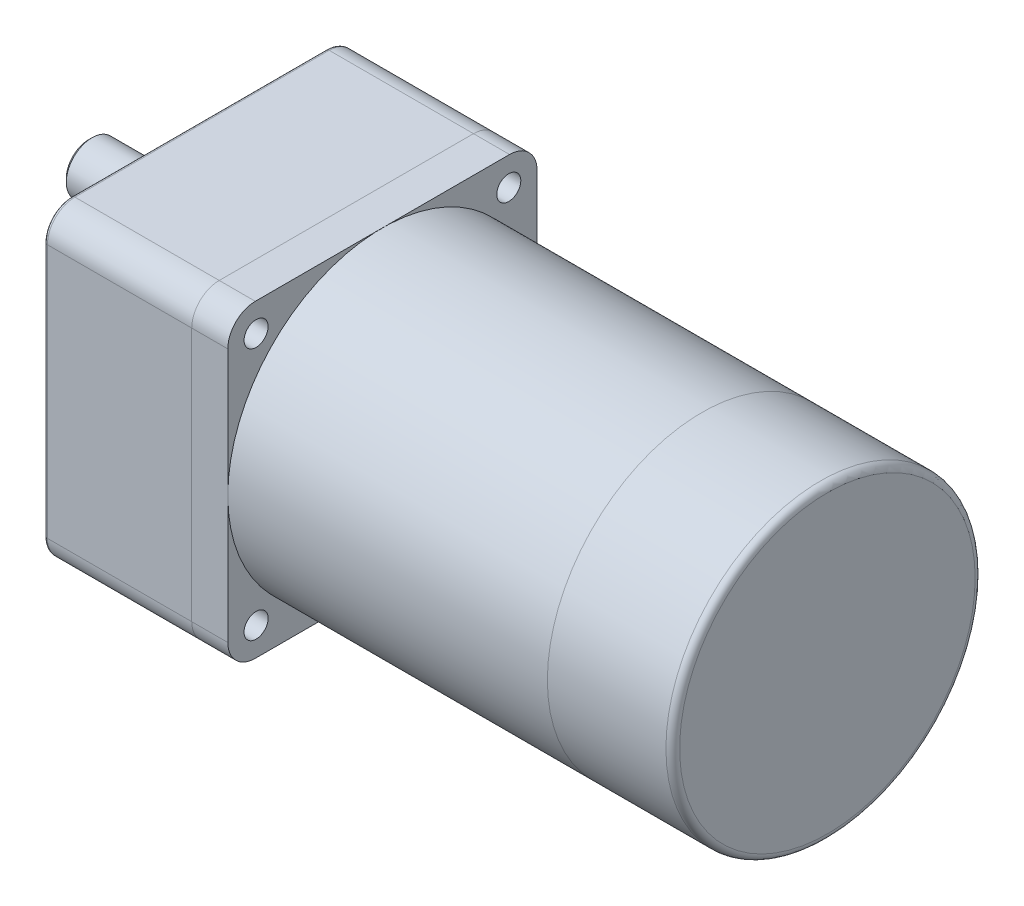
SolidWorks part; units mm, degrees
ref_plane "前视基准面" through (0, 0, 0) normal (0, 0, 1) x (1, 0, 0)
ref_plane "上视基准面" through (0, 0, 0) normal (0, 1, 0) x (1, 0, 0)
ref_plane "右视基准面" through (0, 0, 0) normal (1, 0, 0) x (0, 0, -1)
sketch "草图1" plane through (0, 0, 0) normal (1, 0, 0) x (0, 0, -1)
  line L1 (-37, -45) -> (37, -45)
  line L2 (-45, -37) -> (-45, 37)
  line L3 (-37, 45) -> (37, 45)
  line L4 (45, -37) -> (45, 37)
  line L5 (-45, -45) -> (45, 45) construction
  line L6 (-45, 45) -> (45, -45) construction
  arc A0 (-37, -45) -> (-45, -37) centre (-37, -37) cw
  arc A1 (37, -45) -> (45, -37) centre (37, -37) ccw
  arc A2 (37, 45) -> (45, 37) centre (37, 37) cw
  arc A3 (-45, 37) -> (-37, 45) centre (-37, 37) cw
  point P0 (0, 0)
  dimension "D1" = 8
extrude "凸台-拉伸1" add sketch "草图1" along normal blind 43
sketch "草图2" plane through (43, 0, 0) normal (1, 0, 0) x (0, 0, -1)
  line L0 (37, 45) -> (-37, 45) construction
  line L1 (-37, -45) -> (37, -45)
  line L2 (-45, -37) -> (-45, 37)
  line L3 (-37, 45) -> (37, 45)
  line L4 (45, -37) -> (45, 37)
  line L5 (-45, -45) -> (45, 45) construction
  line L6 (-45, 45) -> (45, -45) construction
  arc A0 (37, 45) -> (45, 37) centre (37, 37) cw
  arc A1 (37, -45) -> (45, -37) centre (37, -37) ccw
  arc A2 (-37, -45) -> (-45, -37) centre (-37, -37) cw
  arc A3 (-45, 37) -> (-37, 45) centre (-37, 37) cw
  point P0 (0, 0)
  dimension "D1" = 8
extrude "凸台-拉伸2" add sketch "草图2" along normal blind 10.5 separate body
fillet "圆角1" radius 1 8 edges at (0, -45, 0) (0, -42.6569, -42.6569) (0, 0, -45) (0, 42.6569, -42.6569) (0, 45, 0) (0, 42.6569, 42.6569) (0, 0, 45) (0, -42.6569, 42.6569)
sketch "草图6" plane through (0, 0, 0) normal (-1, 0, 0) x (0, 0, 1)
  circle A0 centre (0, 18) radius 16
extrude "凸台-拉伸5" add sketch "草图6" along normal blind 3 separate body
fillet "圆角3" radius 0.5 1 edges at (-3, 18, 16)
sketch "草图7" plane through (-3, 0, 0) normal (-1, 0, 0) x (0, 0, 1)
  circle A0 centre (0, 18) radius 7.5
extrude "凸台-拉伸6" add sketch "草图7" along normal blind 29 separate body
ref_plane "基准面1" through (0, 0, -7.5) normal (0, 0, 1) x (1, 0, 0)
sketch "草图8" plane through (0, 0, -7.5) normal (0, 0, 1) x (1, 0, 0)
  line L1 (-32, 25.5) -> (-32, 10.5) construction
  line L2 (-9.5, 20.5) -> (-32, 20.5)
  line L3 (-32, 20.5) -> (-32, 15.5)
  line L4 (-32, 15.5) -> (-9.5, 15.5)
  arc A0 (-9.5, 15.5) -> (-9.5, 20.5) centre (-9.5, 18) ccw
extrude "切除-拉伸2" cut sketch "草图8" along normal blind 3
chamfer "倒角2" distance 1 angle 45 1 edges at (-32, 18, 7.5)
sketch "草图9" plane through (0, 0, 0) normal (-1, 0, 0) x (0, 0, 1)
  circle A0 centre (0, 0) radius 41.4
extrude "切除-拉伸3" cut sketch "草图9" against normal blind 0.5
fillet "圆角4" radius 0.5 1 edges at (0, 0, 41.4)
sketch "草图10" plane through (0, 0, 0) normal (-1, 0, 0) x (0, 0, 1)
  point P19 (-36.7696, 36.7696)
  point P20 (36.7696, 36.7696)
  point P21 (36.7696, -36.7696)
  point P22 (-36.7696, -36.7696)
hole_wizard "M6 螺纹孔1" positions "3D草图1" profile "草图11" tap size "M6" standard "GB"
sketch3d "3D草图1"
  point P0 (0, 36.7696, -36.7696)
  point P3 (0, 36.7696, 36.7696)
  point P6 (0, -36.7696, 36.7696)
  point P9 (0, -36.7696, -36.7696)
sketch "草图11" plane through (0, 36.7696, -36.7696) normal (0, 1, 0) x (0, 0, 1)
  line L0 (0, 0) -> (0, 18.5022)
  line L1 (0, 18.5022) -> (2.5, 17)
  line L2 (2.5, 17) -> (2.5, 0)
  line L5 (2.5, 0) -> (0, 0)
  line L10 (0, 18.5022) -> (-2.5, 17) construction
  line L11 (0, -6.35) -> (0, 107.95) construction
  dimension "螺纹孔钻头直径" = 5
  dimension "螺纹孔钻头深度" = 17
  dimension "导头角度" = 118
sketch "草图13" plane through (53.5, 0, 0) normal (1, 0, 0) x (0, 0, -1)
  circle A0 centre (-36.7696, 36.7696) radius 3.5
  circle A1 centre (36.7696, 36.7696) radius 3.5
  circle A2 centre (36.7696, -36.7696) radius 3.5
  circle A3 centre (-36.7696, -36.7696) radius 3.5
extrude "切除-拉伸4" cut sketch "草图13" against normal blind 44
fillet "圆角5" radius 1 4 edges at (0, -36.7696, -34.2696) (0, -36.7696, 39.2696) (0, 36.7696, 39.2696) (0, 36.7696, -34.2696)
sketch "草图14" plane through (53.5, 0, 0) normal (1, 0, 0) x (0, 0, -1)
  circle A0 centre (0, 0) radius 45
extrude "凸台-拉伸7" add sketch "草图14" along normal blind 93 separate body
sketch "草图15" plane through (146.5, 0, 0) normal (1, 0, 0) x (0, 0, -1)
  circle A0 centre (0, 0) radius 45
extrude "凸台-拉伸8" add sketch "草图15" along normal blind 36.5 separate body
fillet "圆角6" radius 2 1 edges at (183, 0, -45)
